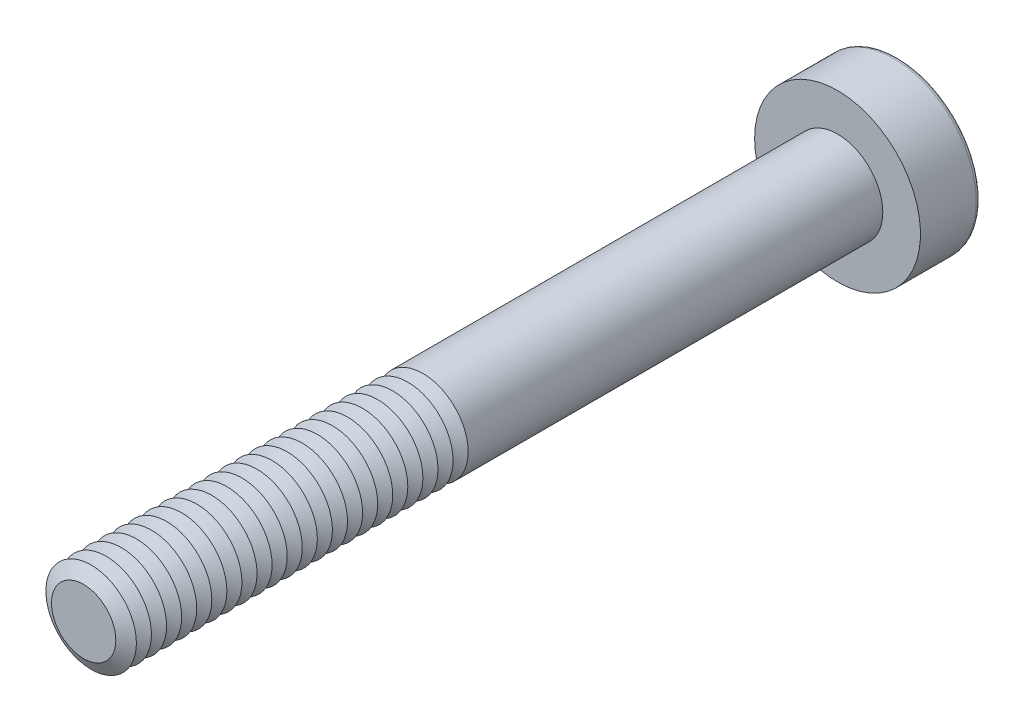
SolidWorks part; units mm, degrees
ref_plane "Front Plane" through (0, 0, 0) normal (0, 0, 1) x (1, 0, 0)
ref_plane "Top Plane" through (0, 0, 0) normal (0, 1, 0) x (1, 0, 0)
ref_plane "Right Plane" through (0, 0, 0) normal (1, 0, 0) x (0, 0, -1)
sketch "Sketch1" plane through (0, 0, 0) normal (0, 0, 1) x (1, 0, 0)
  circle A0 centre (0, 0) radius 1.5
  dimension "D1" = 3
extrude "Boss-Extrude1" add sketch "Sketch1" along normal blind 25
sketch "Sketch2" plane through (0, 0, 0) normal (0, 0, -1) x (-1, 0, 0)
  circle A0 centre (0, 0) radius 2.75
  dimension "D1" = 5.5
extrude "Boss-Extrude2" add sketch "Sketch2" along normal blind 2
sketch "Sketch3" plane through (0, 0, -2) normal (0, 0, -1) x (-1, 0, 0)
  line L1 (-0.5774, 1) -> (-1.1547, 0)
  line L2 (-1.1547, 0) -> (-0.5774, -1)
  line L3 (-0.5774, -1) -> (0.5774, -1)
  line L4 (0.5774, -1) -> (1.1547, 0)
  line L5 (1.1547, 0) -> (0.5774, 1)
  line L6 (0.5774, 1) -> (-0.5774, 1)
  circle A0 centre (0, 0) radius 1 construction
  dimension "D1" = 2
extrude "Cut-Extrude1" cut sketch "Sketch3" against normal blind 1.5
fillet "Fillet1" radius 0.15 1 edges at (-2.75, 0, -2)
sketch "Sketch4" plane through (0, 0, -0.5) normal (0, 0, -1) x (-1, 0, 0)
  line L0 (0.5774, -1) -> (1.1547, 0) construction
  circle A0 centre (0, 0) radius 1
extrude "Cut-Extrude2" cut sketch "Sketch4" against normal through all draft 60
sketch "Sketch5" plane through (0, 0, -2) normal (0, 0, -1) x (-1, 0, 0)
  circle A0 centre (0, 0) radius 1.1547
extrude "Cut-Extrude3" cut sketch "Sketch5" against normal through all draft 75
sketch "Sketch7" plane through (0, 0, 0) normal (1, 0, 0) x (0, 0, -1)
  line L25 (-25, 1.067) -> (-24.75, 1.5)
  line L26 (-25, 1.5) -> (-25, -1.5) construction
  line L27 (-24.75, 1.5) -> (-25.25, 1.5)
  line L28 (-25.25, 1.5) -> (-25, 1.067)
  line L29 (0, 1.5) -> (-25, 1.5) construction
  dimension "D1" = 0.5
revolve "Cut-Revolve1" cut sketch "Sketch7" angle 360 about axis through (0, 0, 25) along (0, 0, -1)
pattern_linear "LPattern1" count 23 spacing 0.5 along (0, 0, -1) of "Cut-Revolve1"
